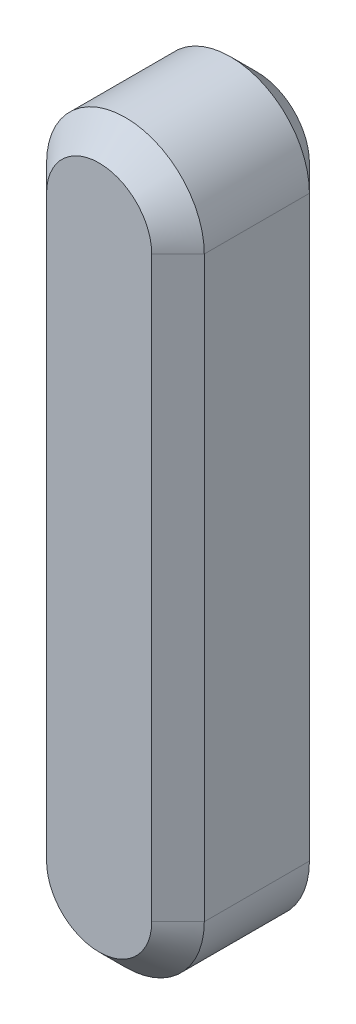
SolidWorks part; units mm, degrees
ref_plane "Plan de face" through (0, 0, 0) normal (0, 0, 1) x (1, 0, 0)
ref_plane "Plan de dessus" through (0, 0, 0) normal (0, 1, 0) x (1, 0, 0)
ref_plane "Plan de droite" through (0, 0, 0) normal (1, 0, 0) x (0, 0, -1)
sketch "Esquisse1" plane through (0, 0, 0) normal (0, 0, 1) x (1, 0, 0)
  line L0 (-1.5, 0) -> (-1.5, -11)
  line L1 (1.5, 0) -> (1.5, -11)
  arc A0 (1.5, 0) -> (-1.5, 0) centre (0, 0) ccw
  arc A1 (-1.5, -11) -> (1.5, -11) centre (0, -11) ccw
  dimension "D1" = 3
  dimension "D2" = 3
  dimension "D3" = 11
extrude "Boss.-Extru.1" add sketch "Esquisse1" along normal blind 3
chamfer "Chanfrein1" distance 0.5 angle 45 8 edges at (0, -12.5, 0) (1.5, -5.5, 0) (0, 1.5, 0) (-1.5, -5.5, 0) (0, -12.5, 3) (-1.5, -5.5, 3) (0, 1.5, 3) (1.5, -5.5, 3)
